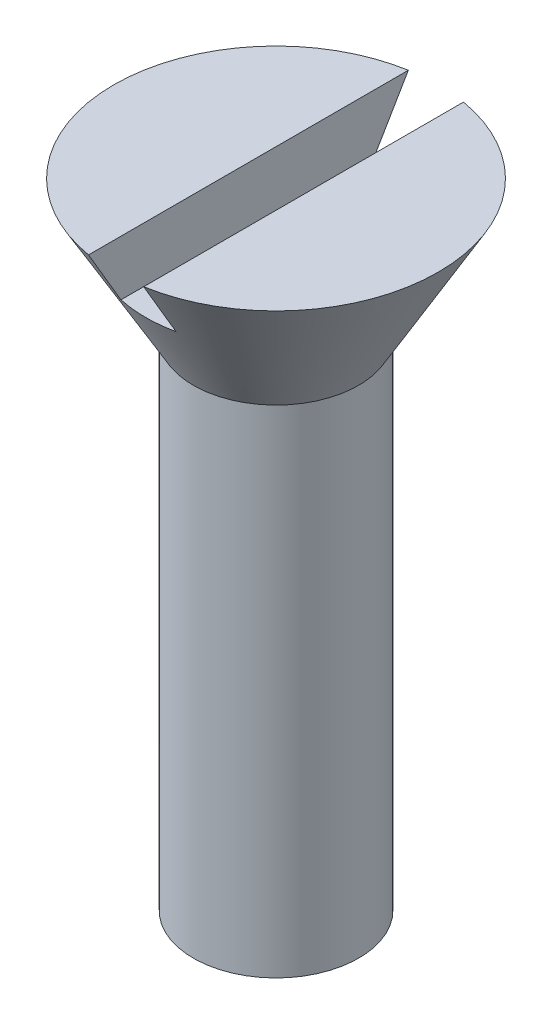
SolidWorks part; units mm, degrees
ref_plane "Front Plane" through (0, 0, 0) normal (0, 0, 1) x (1, 0, 0)
ref_plane "Top Plane" through (0, 0, 0) normal (0, 1, 0) x (1, 0, 0)
ref_plane "Right Plane" through (0, 0, 0) normal (1, 0, 0) x (0, 0, -1)
sketch "Sketch1" plane through (0, 0, 0) normal (0, 0, 1) x (1, 0, 0)
  line L0 (0, 0) -> (3, 1.7321)
  line L1 (3, 1.7321) -> (3, 19.7321)
  line L2 (3, 19.7321) -> (5.8868, 24.7321)
  line L3 (5.8868, 24.7321) -> (0, 24.7321)
  line L4 (0, 24.7321) -> (0, 0)
  line L5 (0, 37.3132) -> (0, 24.7321) construction
  dimension "D1" = 6
  dimension "D2" = 60
  dimension "D3" = 18
  dimension "D4" = 5
  dimension "D5" = 30
revolve "Revolve1" add sketch "Sketch1" angle 360 about L5
sketch "Sketch2" plane through (0, 24.7321, 0) normal (0, 1, 0) x (1, 0, 0)
  line L1 (-1, -7.2036) -> (1, -7.2036)
  line L2 (-1, -7.2036) -> (-1, 7.2036)
  line L3 (-1, 7.2036) -> (1, 7.2036)
  line L4 (1, -7.2036) -> (1, 7.2036)
  line L5 (-1, -7.2036) -> (1, 7.2036) construction
  line L6 (-1, 7.2036) -> (1, -7.2036) construction
  point P0 (0, 0)
  dimension "D1" = 2
extrude "Cut-Extrude1" cut sketch "Sketch2" against normal blind 2
